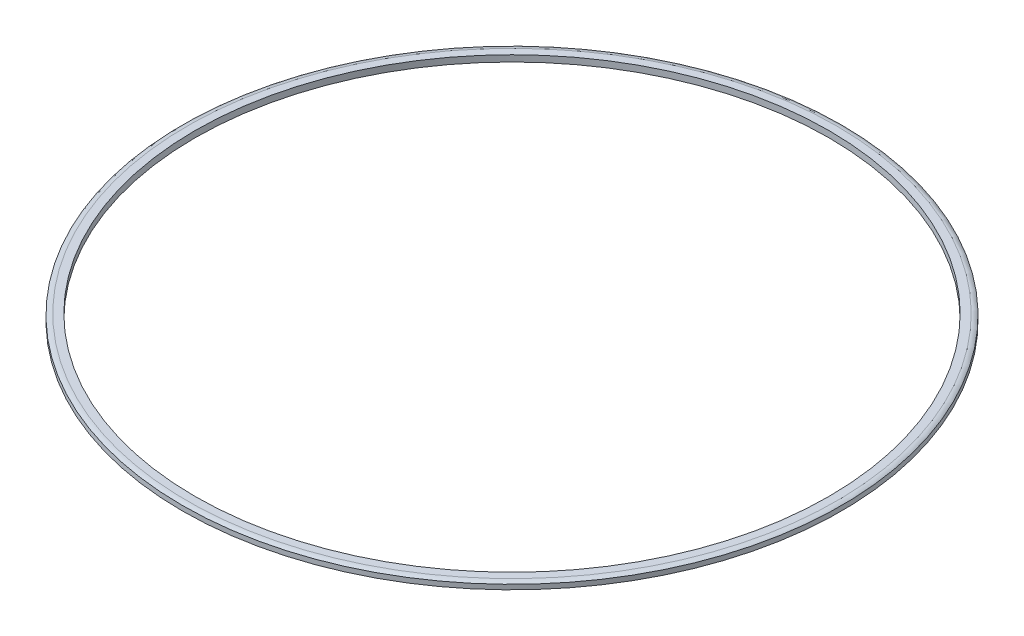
SolidWorks part; units mm, degrees
ref_plane "Plan de face" through (0, 0, 0) normal (0, 0, 1) x (1, 0, 0)
ref_plane "Plan de dessus" through (0, 0, 0) normal (0, 1, 0) x (1, 0, 0)
ref_plane "Plan de droite" through (0, 0, 0) normal (1, 0, 0) x (0, 0, -1)
sketch "Esquisse1" plane through (0, 0, 0) normal (0, 0, 1) x (1, 0, 0)
  line L0 (-300.911, 0) -> (-312.911, 0)
  line L1 (-300.911, 0) -> (-300.911, 6)
  line L2 (-312.911, 0) -> (-312.911, 4.555)
  line L3 (-300.911, 6) -> (-308.325, 6)
  line L4 (0, -40.8119) -> (0, 40.8119) construction
  arc A0 (-308.325, 6) -> (-312.911, 4.555) centre (-308.325, -2) ccw
  dimension "D4" = 8
  dimension "D1" = 12
  dimension "D2" = 6
  dimension "D3" = 7.414
  dimension "D5" = 300.911
revolve "Révolution1" add sketch "Esquisse1" angle 360 about L4
sketch "Esquisse2" plane through (0, 0, 0) normal (0, 0, 1) x (1, 0, 0)
  line L0 (-305.871, 0) -> (-305.4339, 2.4791)
  line L1 (-312.911, 0) -> (312.911, 0) construction
  line L2 (-305.4339, 2.4791) -> (-308.3883, 3)
  line L3 (-308.3883, 3) -> (-308.9173, 0)
  line L4 (-308.9173, 0) -> (-305.871, 0)
  line L6 (-312.911, 4.555) -> (-312.911, 0) construction
  dimension "D1" = 4.96
  dimension "D2" = 3
  dimension "D3" = 3
  dimension "D4" = 10
revolve "Enlèvement de matière-Révolution1" cut sketch "Esquisse2" angle 360
